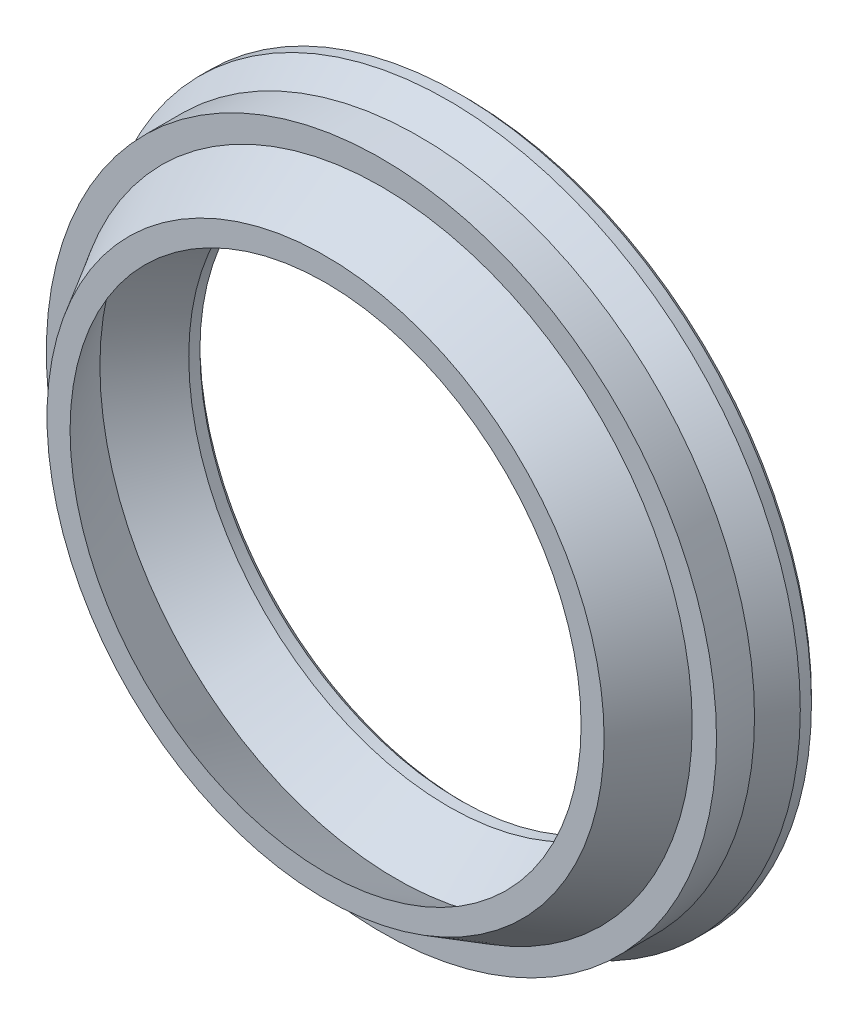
SolidWorks part; units mm, degrees
ref_plane "Front" through (0, 0, 0) normal (0, 0, 1) x (1, 0, 0)
ref_plane "Top" through (0, 0, 0) normal (0, 1, 0) x (1, 0, 0)
ref_plane "Right" through (0, 0, 0) normal (1, 0, 0) x (0, 0, -1)
sketch "Sketch1" plane through (21, 0, -3.1487) normal (0, 1, 0) x (-1, 0, 0)
  line L0 (21, 10.6441) -> (21, -7.4954) construction
  line L1 (41, -2.4526) -> (41, -0.1846)
  line L2 (41, -0.1846) -> (39.5495, -0.1846)
  line L3 (39.5495, -0.1846) -> (37.625, 3.1487)
  line L4 (37.625, 3.1487) -> (36.25, 3.1487)
  line L5 (41, -2.4526) -> (42, -4.1846)
  line L6 (42, -4.1846) -> (42, -5.1846)
  line L7 (42, -5.1846) -> (36.5, -5.1846)
  line L8 (36.5, -5.1846) -> (36.5, -4.1846)
  line L9 (36.5, -4.1846) -> (38.6835, -1.0662)
  line L10 (38.6835, -1.0662) -> (36.25, 3.1487)
  dimension "D1" = 30.5
  dimension "WD" = 40
  dimension "D2" = 31
  dimension "h" = 5
  dimension "D5" = 1
  dimension "D6" = 3.3333
  dimension "S" = 5.5
  dimension "D8" = 120
  dimension "D9" = 1.375
  dimension "D10" = 150
  dimension "D11" = 115
revolve "Body" add sketch "Sketch1" angle 360 about L0
sketch "Sketch2" plane through (19.25, 0, -11.3374) normal (0, 1, 0) x (-1, 0, 0)
  line L0 (19.25, 13.8484) -> (19.25, -2.511) construction
  line L2 (1, -0.9653) -> (1, -0.0415) construction
  line L3 (2, 3.0041) -> (0, 3.0041)
  line L5 (0, 3.0041) -> (0.4619, 3.8041)
  line L6 (0.4619, 3.8041) -> (1.5381, 3.8041)
  line L7 (1.5381, 3.8041) -> (2, 3.0041)
  line L9 (-1.75, 4.0041) -> (-1.75, 3.0041) construction
  line L10 (-1.75, 3.0041) -> (40.25, 3.0041) construction
  dimension "D1" = 2.75
  dimension "D2" = 0.8
  dimension "D3" = 60
  dimension "D4" = 2
revolve "Cut-Revolve1" cut sketch "Sketch2" angle 360 about L0
chamfer "EndChamfer" distance 0.3333 angle 45 2 edges at (15.5, 0, -8.3333) (21, 0, -8.3333)
equation "\"D5@Sketch1\" = \"h@Sketch1\" / 5"
equation "\"D9@Sketch1\" = \"S@Sketch1\" / 4"
equation "\"D6@Sketch1\" = 2 * \"h@Sketch1\" / 3"
equation "\"D1@EndChamfer\" = \"h@Sketch1\" / 15"
